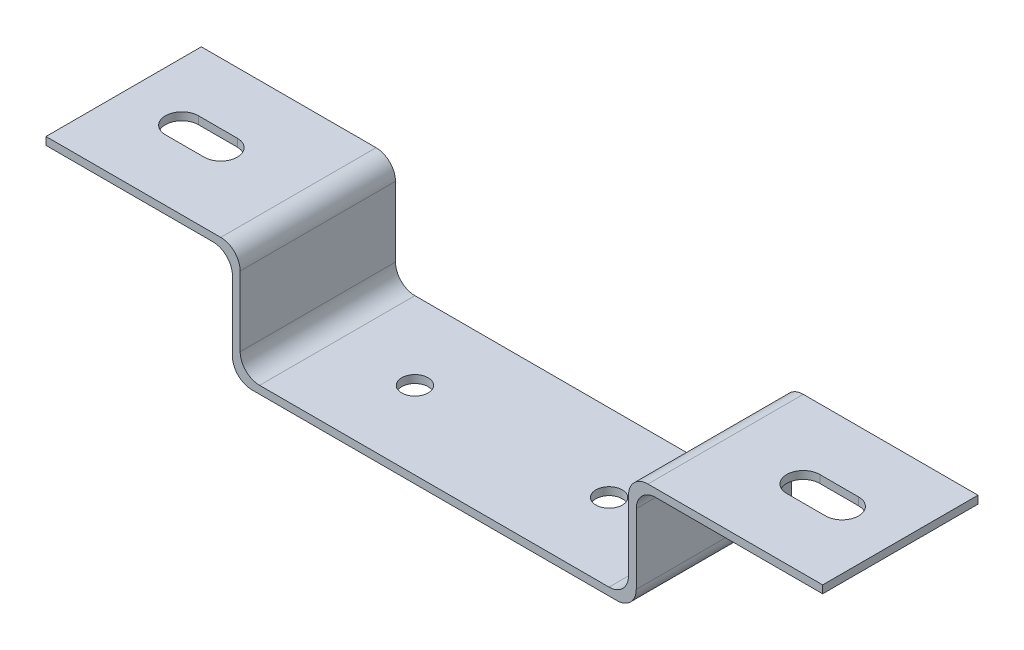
SolidWorks part; units mm, degrees
ref_plane "前基準面" through (0, 0, 0) normal (0, 0, 1) x (1, 0, 0)
ref_plane "上基準面" through (0, 0, 0) normal (0, 1, 0) x (1, 0, 0)
ref_plane "右基準面" through (0, 0, 0) normal (1, 0, 0) x (0, 0, -1)
sketch "草圖1" plane through (0, 0, 0) normal (0, 0, 1) x (1, 0, 0)
  line L0 (0, 0) -> (45, 0)
  line L1 (50, -5) -> (50, -23)
  line L2 (55, -28) -> (145, -28)
  line L3 (150, -23) -> (150, -5)
  line L4 (155, 0) -> (200, 0)
  line L5 (0, -2) -> (43, -2)
  line L6 (48, -7) -> (48, -25)
  line L7 (53, -30) -> (147, -30)
  line L8 (152, -25) -> (152, -7)
  line L9 (157, -2) -> (200, -2)
  line L10 (0, 0) -> (0, -2)
  line L11 (200, 0) -> (200, -2)
  line L12 (48, -30) -> (152, -30) construction
  line L13 (152, -30) -> (152, -2) construction
  line L14 (150, -28) -> (150, 0) construction
  line L15 (50, -28) -> (150, -28) construction
  line L16 (150, 0) -> (200, 0) construction
  line L17 (152, -2) -> (200, -2) construction
  line L18 (50, 0) -> (50, -28) construction
  line L19 (0, 0) -> (50, 0) construction
  line L20 (0, -2) -> (48, -2) construction
  line L21 (48, -2) -> (48, -30) construction
  arc A0 (147, -30) -> (152, -25) centre (147, -25) ccw
  arc A1 (150, -23) -> (145, -28) centre (145, -23) cw
  arc A2 (150, -5) -> (155, 0) centre (155, -5) cw
  arc A3 (157, -2) -> (152, -7) centre (157, -7) ccw
  arc A4 (50, -5) -> (45, 0) centre (45, -5) ccw
  arc A5 (43, -2) -> (48, -7) centre (43, -7) cw
  arc A6 (55, -28) -> (50, -23) centre (55, -23) cw
  arc A7 (48, -25) -> (53, -30) centre (53, -25) ccw
  point P19 (150, -28)
  point P29 (50, 0)
  dimension "D6" = 5
  dimension "D1" = 30
  dimension "D2" = 50
  dimension "D3" = 50
  dimension "D4" = 200
  dimension "D5" = 2
extrude "填料-伸長1" add sketch "草圖1" along normal blind 40
sketch "草圖2" plane through (0, -2, 0) normal (0, -1, 0) x (1, 0, 0)
  line L0 (185, 20) -> (175, 20) construction
  line L1 (185, 15.75) -> (175, 15.75)
  line L2 (185, 24.25) -> (175, 24.25)
  line L3 (200, 40) -> (200, 0) construction
  line L4 (157, 40) -> (200, 40) construction
  line L5 (25, 20) -> (15, 20) construction
  line L6 (25, 15.75) -> (15, 15.75)
  line L7 (25, 24.25) -> (15, 24.25)
  line L9 (0, 40) -> (0, 0) construction
  arc A0 (185, 15.75) -> (185, 24.25) centre (185, 20) ccw
  arc A1 (175, 24.25) -> (175, 15.75) centre (175, 20) ccw
  arc A2 (25, 15.75) -> (25, 24.25) centre (25, 20) ccw
  arc A3 (15, 24.25) -> (15, 15.75) centre (15, 20) ccw
  point P2 (180, 20)
  point P13 (20, 20)
  dimension "D1" = 4.25
  dimension "D6" = 4.25
  dimension "D2" = 10
  dimension "D3" = 20
  dimension "D4" = 20
  dimension "D5" = 10
  dimension "D7" = 20
extrude "除料-伸長1" cut sketch "草圖2" against normal up to next
hole_wizard "M8 螺紋孔1" positions "草圖4" profile "草圖3" tap size "M8" standard "IS"
sketch "草圖4" plane through (0, -30, 0) normal (0, -1, 0) x (1, 0, 0)
  line L0 (53, 40) -> (147, 40) construction
  line L3 (200, 40) -> (200, 0) construction
  point P0 (75, 20)
  point P6 (125, 20)
  dimension "D1" = 20
  dimension "D2" = 75
  dimension "D3" = 50
sketch "草圖3" plane through (75, -30, 20) normal (1, 0, 0) x (0, 0, -1)
  line L0 (0, 0) -> (0, 21.7929)
  line L1 (0, 21.7929) -> (3.4, 19.75)
  line L2 (3.4, 19.75) -> (3.4, 0)
  line L5 (3.4, 0) -> (0, 0)
  line L10 (0, 21.7929) -> (-3.4, 19.75) construction
  line L11 (0, -6.35) -> (0, 107.95) construction
  dimension "螺孔鑽直徑" = 6.8
  dimension "螺孔鑽深度" = 19.75
  dimension "導頭角度" = 118
